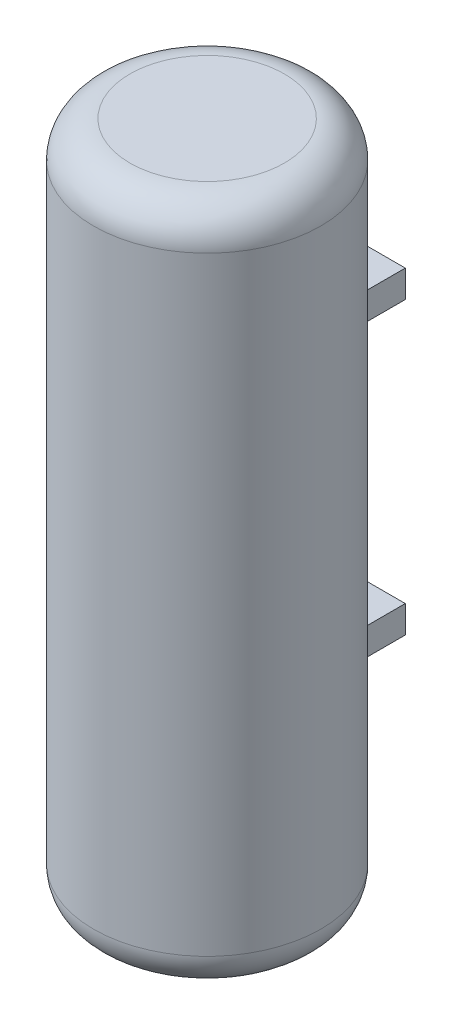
SolidWorks part; units mm, degrees
ref_plane "Plan de face" through (0, 0, 0) normal (0, 0, 1) x (1, 0, 0)
ref_plane "Plan de dessus" through (0, 0, 0) normal (0, 1, 0) x (1, 0, 0)
ref_plane "Plan de droite" through (0, 0, 0) normal (1, 0, 0) x (0, 0, -1)
sketch "Esquisse1" plane through (0, 0, 0) normal (0, 1, 0) x (1, 0, 0)
  circle A0 centre (0, 0) radius 250
  dimension "D1" = 500
extrude "Boss.-Extru.1" add sketch "Esquisse1" along normal blind 1500
fillet "Congé1" radius 80 2 edges at (0, 1500, 250) (0, 0, 250)
sketch "Esquisse2" plane through (0, 0, 0) normal (0, -1, 0) x (1, 0, 0)
  circle A0 centre (0, 0) radius 75
  dimension "D1" = 150
extrude "Boss.-Extru.2" add sketch "Esquisse2" along normal blind 60
chamfer "Chanfrein1" distance 20 angle 45 1 edges at (0, -60, -75)
sketch "Esquisse3" plane through (0, 0, 0) normal (0, 0, 1) x (1, 0, 0)
  line L1 (-150, 1146.9371) -> (150, 1146.9371)
  line L2 (-150, 1146.9371) -> (-150, 1086.9371)
  line L3 (-150, 1086.9371) -> (150, 1086.9371)
  line L4 (150, 1146.9371) -> (150, 1086.9371)
  line L5 (-150, 507.6315) -> (150, 507.6315)
  line L6 (-150, 507.6315) -> (-150, 447.6315)
  line L7 (-150, 447.6315) -> (150, 447.6315)
  line L8 (150, 507.6315) -> (150, 447.6315)
  dimension "D1" = 150
  dimension "D2" = 300
  dimension "D3" = 300
  dimension "D4" = 150
  dimension "D5" = 60
  dimension "D6" = 60
extrude "Boss.-Extru.3" add sketch "Esquisse3" against normal blind 286
